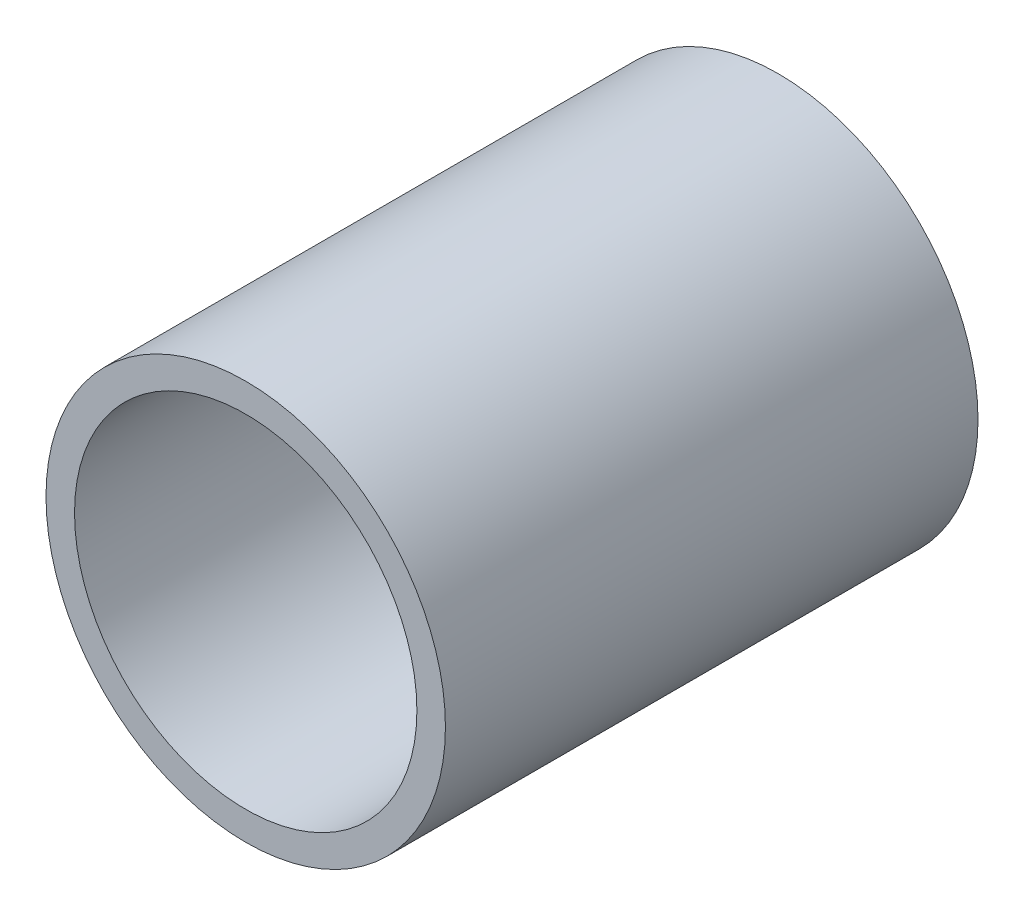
SolidWorks part; units mm, degrees
ref_plane "前视基准面" through (0, 0, 0) normal (0, 0, 1) x (1, 0, 0)
ref_plane "上视基准面" through (0, 0, 0) normal (0, 1, 0) x (1, 0, 0)
ref_plane "右视基准面" through (0, 0, 0) normal (1, 0, 0) x (0, 0, -1)
sketch "草图1" plane through (0, 0, 0) normal (0, 0, 1) x (1, 0, 0)
  circle A0 centre (-4.5, 0) radius 10.5
  circle A1 centre (-4.5, 0) radius 9
  circle A2 centre (-4.5, 0) radius 10.5 construction
  circle A3 centre (-4.5, 0) radius 9 construction
extrude "拉伸1" add sketch "草图1" against normal up to surface (28 mm away)
